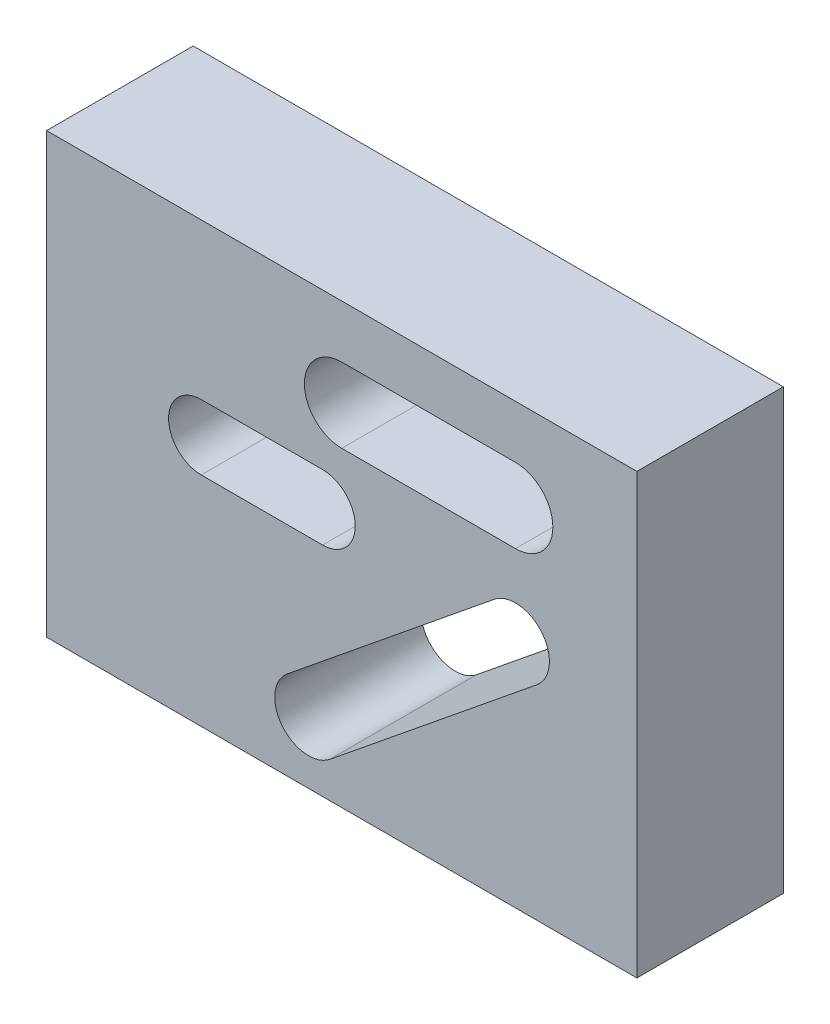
SolidWorks part; units mm, degrees
ref_plane "Vorderansicht" through (0, 0, 0) normal (0, 0, 1) x (1, 0, 0)
ref_plane "Oben" through (0, 0, 0) normal (0, 1, 0) x (1, 0, 0)
ref_plane "Rechts" through (0, 0, 0) normal (1, 0, 0) x (0, 0, -1)
sketch "Skizze1" plane through (0, 0, 0) normal (0, 0, 1) x (1, 0, 0)
  line L0 (52.3747, 61.8468) -> (83.2135, 61.8468) construction
  line L1 (0, 0) -> (104.7494, 0)
  line L2 (0, 0) -> (0, 77.8607)
  line L3 (0, 77.8607) -> (104.7494, 77.8607)
  line L4 (104.7494, 0) -> (104.7494, 77.8607)
  line L5 (52.3747, 68.4733) -> (83.2135, 68.4733)
  line L6 (52.3747, 55.2204) -> (83.2135, 55.2204)
  line L7 (27.4409, 44.4524) -> (48.9769, 44.4524) construction
  line L8 (27.4409, 50.2505) -> (48.9769, 50.2505)
  line L9 (27.4409, 38.6543) -> (48.9769, 38.6543)
  line L10 (83.2135, 40.8631) -> (46.4919, 11.0441) construction
  line L11 (87.0037, 36.1955) -> (50.2822, 6.3765)
  line L12 (79.4233, 45.5307) -> (42.7017, 15.7117)
  arc A0 (52.3747, 68.4733) -> (52.3747, 55.2204) centre (52.3747, 61.8468) ccw
  arc A1 (83.2135, 55.2204) -> (83.2135, 68.4733) centre (83.2135, 61.8468) ccw
  arc A2 (27.4409, 50.2505) -> (27.4409, 38.6543) centre (27.4409, 44.4524) ccw
  arc A3 (48.9769, 38.6543) -> (48.9769, 50.2505) centre (48.9769, 44.4524) ccw
  arc A4 (87.0037, 36.1955) -> (79.4233, 45.5307) centre (83.2135, 40.8631) ccw
  arc A5 (42.7017, 15.7117) -> (50.2822, 6.3765) centre (46.4919, 11.0441) ccw
  point P7 (67.7941, 61.8468)
  point P12 (38.2089, 44.4524)
  point P19 (64.8527, 25.9536)
  point P26 (0, 0)
extrude "Aufsatz-Linear austragen1" add sketch "Skizze1" along normal blind 26
